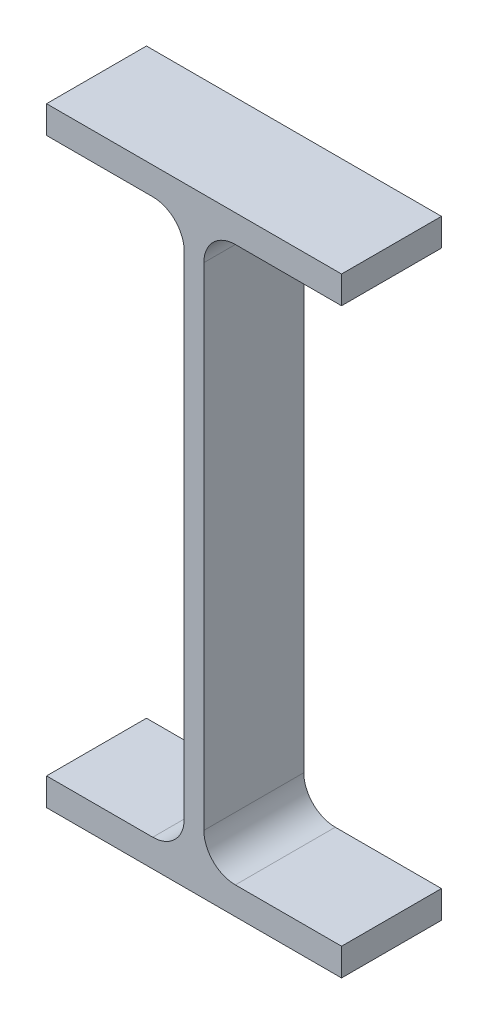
SolidWorks part; units mm, degrees
ref_plane "Front Plane" through (0, 0, 0) normal (0, 0, 1) x (1, 0, 0)
ref_plane "Top Plane" through (0, 0, 0) normal (0, 1, 0) x (1, 0, 0)
ref_plane "Right Plane" through (0, 0, 0) normal (1, 0, 0) x (0, 0, -1)
other "Configuration Table"
sketch "Sketch1" plane through (0, 0, 0) normal (0, 0, 1) x (1, 0, 0)
  line L0 (0, 72.9931) -> (0, -63.9253) construction
  line L1 (-37.5, 77.5) -> (37.5, 77.5)
  line L2 (-37.5, 77.5) -> (-37.5, 70.5)
  line L3 (-37.5, -77.5) -> (37.5, -77.5)
  line L4 (37.5, -70.5) -> (37.5, -77.5)
  line L5 (-42.3074, 0) -> (60.8749, 0) construction
  line L6 (-37.5, -70.5) -> (-37.5, -77.5)
  line L7 (-37.5, 70.5) -> (-10.5, 70.5)
  line L8 (37.5, -70.5) -> (10.5, -70.5)
  line L9 (-37.5, -70.5) -> (-10.5, -70.5)
  line L10 (-2.5, 62.5) -> (-2.5, -62.5)
  line L11 (2.5, 62.5) -> (2.5, -62.5)
  line L12 (37.5, 70.5) -> (10.5, 70.5)
  line L13 (37.5, 77.5) -> (37.5, 70.5)
  arc A0 (-10.5, 70.5) -> (-2.5, 62.5) centre (-10.5, 62.5) cw
  arc A1 (-10.5, -70.5) -> (-2.5, -62.5) centre (-10.5, -62.5) ccw
  arc A2 (10.5, -70.5) -> (2.5, -62.5) centre (10.5, -62.5) cw
  arc A3 (10.5, 70.5) -> (2.5, 62.5) centre (10.5, 62.5) ccw
  point P18 (0, -77.5)
  point P27 (0, 77.5)
  dimension "Radius" = 8
  dimension "Depth" = 155
  dimension "Width" = 75
  dimension "Web_thickness" = 5
  dimension "Thickness" = 7
extrude "BaseSection" add sketch "Sketch1" along normal mid plane 25.4
